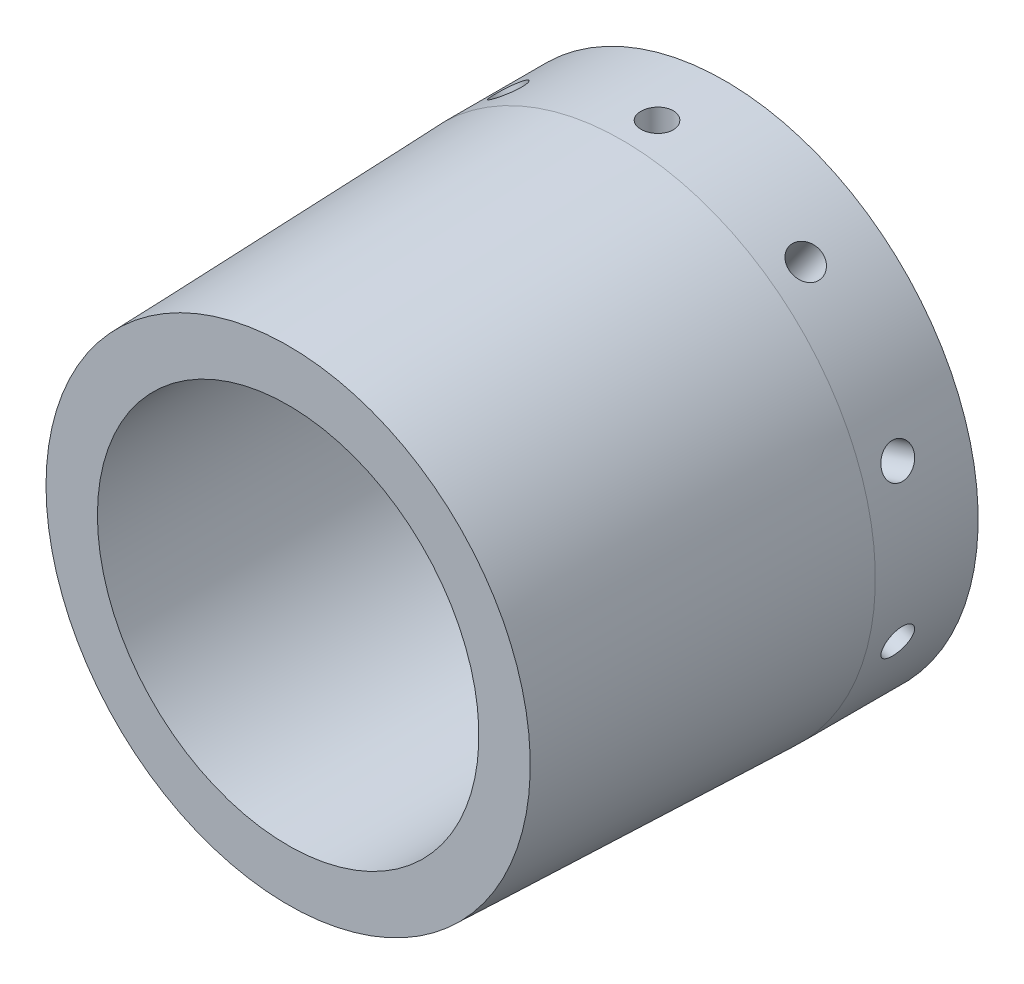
SolidWorks part; units mm, degrees
ref_plane "Front Plane" through (0, 0, 0) normal (0, 0, 1) x (1, 0, 0)
ref_plane "Top Plane" through (0, 0, 0) normal (0, 1, 0) x (1, 0, 0)
ref_plane "Right Plane" through (0, 0, 0) normal (1, 0, 0) x (0, 0, -1)
sketch "Sketch2" plane through (0, 0, 0) normal (0, 1, 0) x (1, 0, 0)
  line L0 (0, 0) -> (-9.3345, 0)
  line L1 (-9.3345, 0) -> (-9.3345, -15.367)
  line L2 (0, 0) -> (0, -65.3002)
  line L3 (0, -65.3002) -> (-7.6835, -65.3002)
  line L4 (-9.3345, -15.367) -> (-7.6835, -65.3002)
  line L5 (28.5115, 0) -> (28.5115, -65.3002) construction
  dimension "D1" = 15.367
  dimension "D2" = 9.3345
  dimension "D3" = 65.3002
  dimension "D4" = 7.6835
  dimension "D5" = 28.5115
revolve "Revolve1" add sketch "Sketch2" angle 360 about L5
ref_plane "Plane1" through (0, 37.846, 0) normal (0, 1, 0) x (1, 0, 0)
sketch "Sketch3" plane through (0, 37.846, 0) normal (0, 1, 0) x (1, 0, 0)
  line L0 (66.3575, 0) -> (-9.3345, 0) construction
  line L8 (28.5115, -65.3002) -> (28.5115, 0) construction
  circle A0 centre (28.5115, -10.16) radius 2.413
  point P5 (28.5115, 0)
  dimension "D1" = 4.826
  dimension "D2" = 10.16
extrude "Cut-Extrude2" cut sketch "Sketch3" against normal up to surface (9.3345 mm away)
pattern_circular "CirPattern3" count 10 over 360 about axis through (28.5115, 0, 0) along (0, 0, -1) of "Cut-Extrude2"
